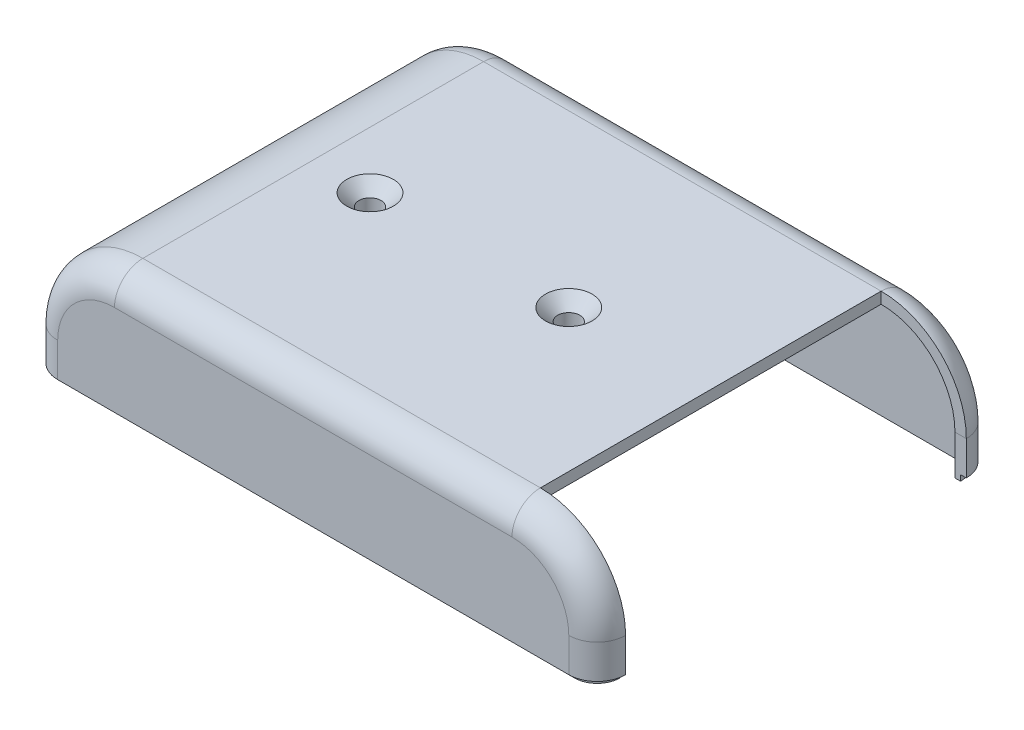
SolidWorks part; units mm, degrees
ref_plane "Front Plane" through (0, 0, 0) normal (0, 0, 1) x (1, 0, 0)
ref_plane "Top Plane" through (0, 0, 0) normal (0, 1, 0) x (1, 0, 0)
ref_plane "Right Plane" through (0, 0, 0) normal (1, 0, 0) x (0, 0, -1)
sketch "Sketch1" plane through (0, 0, 0) normal (0, 1, 0) x (1, 0, 0)
  line L1 (-50, -35) -> (50, -35)
  line L2 (-50, -35) -> (-50, 35)
  line L3 (-50, 35) -> (50, 35)
  line L4 (50, -35) -> (50, 35)
  line L5 (-50, -35) -> (50, 35) construction
  line L6 (-50, 35) -> (50, -35) construction
  point P0 (0, 0)
  dimension "D1" = 100
  dimension "D2" = 70
extrude "Boss-Extrude1" add sketch "Sketch1" along normal blind 21
fillet "Fillet1" radius 15 2 edges at (50, 21, 0) (-50, 21, 0)
fillet "Fillet2" radius 5 10 edges at (50, 3, -35) (45.6066, 16.6066, -35) (-50, 3, -35) (-45.6066, 16.6066, -35) (-50, 3, 35) (-45.6066, 16.6066, 35) (50, 3, 35) (45.6066, 16.6066, 35) (0, 21, -35) (0, 21, 35)
shell "Shell1" thickness 2
ref_plane "Plane1" through (0, 6, 0) normal (0, 1, 0) x (1, 0, 0)
sketch "Sketch3" plane through (0, 6, 0) normal (0, 1, 0) x (1, 0, 0)
  line L0 (-50, -30) -> (-50, 30) construction
  line L1 (-50, 0) -> (35, 0) construction
  line L2 (35, -30) -> (35, 30) construction
  circle A0 centre (-25, 0) radius 3
  circle A1 centre (10, 0) radius 3
  dimension "D1" = 6
  dimension "D2" = 25
  dimension "D3" = 35
extrude "Boss-Extrude2" add sketch "Sketch3" along normal up to next draft 5
hole_wizard "CSK for M3.5 Flat Head Machine Screw1" positions "Sketch4" profile "Sketch5" countersink size "M3.5" standard "ANSI Metric"
sketch "Sketch4" plane through (0, 21, 0) normal (0, 1, 0) x (1, 0, 0)
  circle A0 centre (-25, 0) radius 4.1374 construction
  circle A1 centre (10, 0) radius 4.1374 construction
  point P0 (-25, 0)
  point P2 (10, 0)
sketch "Sketch5" plane through (-25, 21, 0) normal (1, 0, 0) x (0, 0, 1)
  line L0 (0, 0) -> (0, 21)
  line L1 (0, 21) -> (1.95, 21)
  line L2 (1.95, 21) -> (1.95, 2.15)
  line L3 (1.95, 2.15) -> (4.1, 0)
  line L5 (4.1, 0) -> (0, 0)
  line L6 (-1.95, 2.15) -> (-4.1, 0) construction
  line L11 (0, -6.35) -> (0, 107.95) construction
  dimension "Thru Hole Dia." = 3.9
  dimension "Thru Hole Depth" = 21
  dimension "Near C'Sink Dia." = 8.2
  dimension "Near C'Sink Angle" = 90
fillet "Fillet3" radius 1 2 edges at (-25, 19, -4.1374) (10, 19, -4.1374)
sketch "Sketch6" plane through (0, 0, 0) normal (0, -1, 0) x (1, 0, 0)
  line L0 (-45, 33) -> (45, 33) construction
  line L1 (-48, -30) -> (-48, 30) construction
  line L2 (45, -33) -> (-45, -33) construction
  line L3 (-45, 33) -> (45, 33)
  line L4 (-48, -30) -> (-48, 30)
  line L5 (45, -33) -> (-45, -33)
  arc A0 (48, 30) -> (45, 33) centre (45, 30) ccw construction
  arc A1 (-45, 33) -> (-48, 30) centre (-45, 30) ccw construction
  arc A2 (-48, -30) -> (-45, -33) centre (-45, -30) ccw construction
  arc A3 (45, -33) -> (48, -30) centre (45, -30) ccw construction
  arc A4 (48, 30) -> (45, 33) centre (45, 30) ccw
  arc A5 (-45, 33) -> (-48, 30) centre (-45, 30) ccw
  arc A6 (-48, -30) -> (-45, -33) centre (-45, -30) ccw
  arc A7 (45, -33) -> (48, -30) centre (45, -30) ccw
extrude "Extrude-Thin1" add sketch "Sketch6" along normal blind 1 thin
